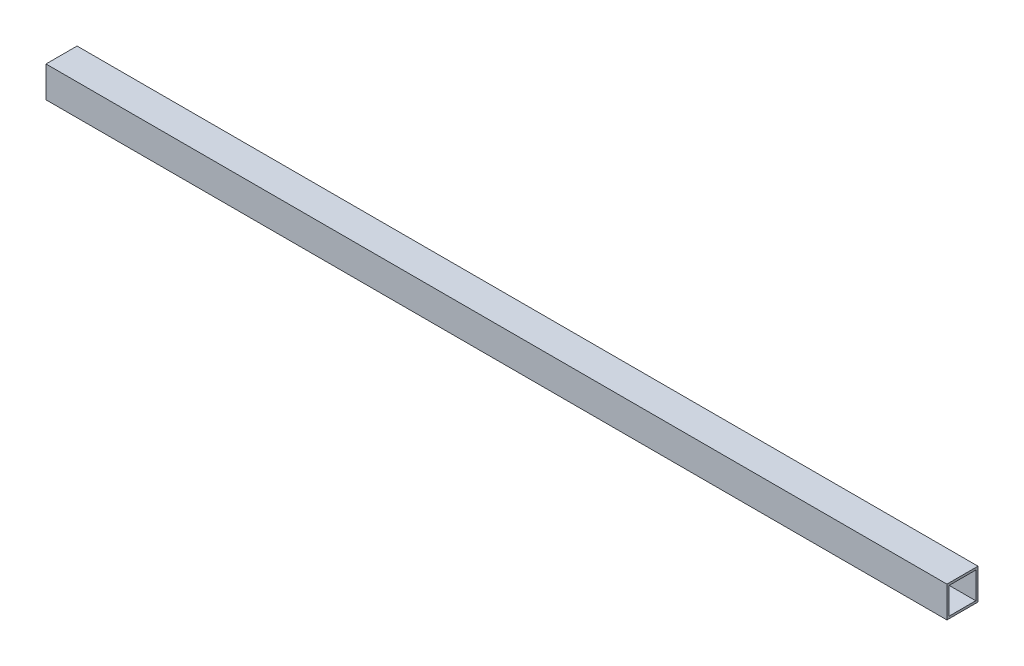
SolidWorks part; units mm, degrees
ref_plane "Front" through (0, 0, 0) normal (0, 0, 1) x (1, 0, 0)
ref_plane "Top" through (0, 0, 0) normal (0, 1, 0) x (1, 0, 0)
ref_plane "Right" through (0, 0, 0) normal (1, 0, 0) x (0, 0, -1)
sketch "Sketch1" plane through (0, 0, 0) normal (1, 0, 0) x (0, 0, -1)
  line L1 (0, 0) -> (50.8, 0)
  line L2 (0, 0) -> (0, 50.8)
  line L3 (0, 50.8) -> (50.8, 50.8)
  line L4 (50.8, 0) -> (50.8, 50.8)
  line L5 (3.6576, 47.1424) -> (47.1424, 47.1424)
  line L6 (3.6576, 47.1424) -> (3.6576, 3.6576)
  line L7 (3.6576, 3.6576) -> (47.1424, 3.6576)
  line L8 (47.1424, 47.1424) -> (47.1424, 3.6576)
  dimension "D1" = 50.8
  dimension "D2" = 50.8
  dimension "D3" = 3.6576
  dimension "D4" = 3.6576
  dimension "D5" = 3.6576
  dimension "D6" = 3.6576
extrude "Extrude1" add sketch "Sketch1" along normal blind 1473.2
sketch "Sketch3" plane through (0, 50.8, 0) normal (0, 1, 0) x (1, 0, 0)
  line L0 (0, 50.8) -> (0, 0) construction
  line L1 (0, 25.4) -> (1473.2, 25.4) construction
  line L2 (1473.2, 50.8) -> (1473.2, 0) construction
  circle A0 centre (12.7, 12.7) radius 3.3731
  circle A1 centre (38.1, 38.1) radius 3.3731
  circle A2 centre (1460.5, 38.1) radius 3.3731
  circle A3 centre (1435.1, 12.7) radius 3.3731
  dimension "D1" = 6.7462
  dimension "D7" = 25.4
  dimension "D8" = 12.7
  dimension "D9" = 12.7
  dimension "D2" = 12.7
  dimension "D3" = 38.1
  dimension "D4" = 12.7
  dimension "D5" = 25.4
  dimension "D6" = 12.7
